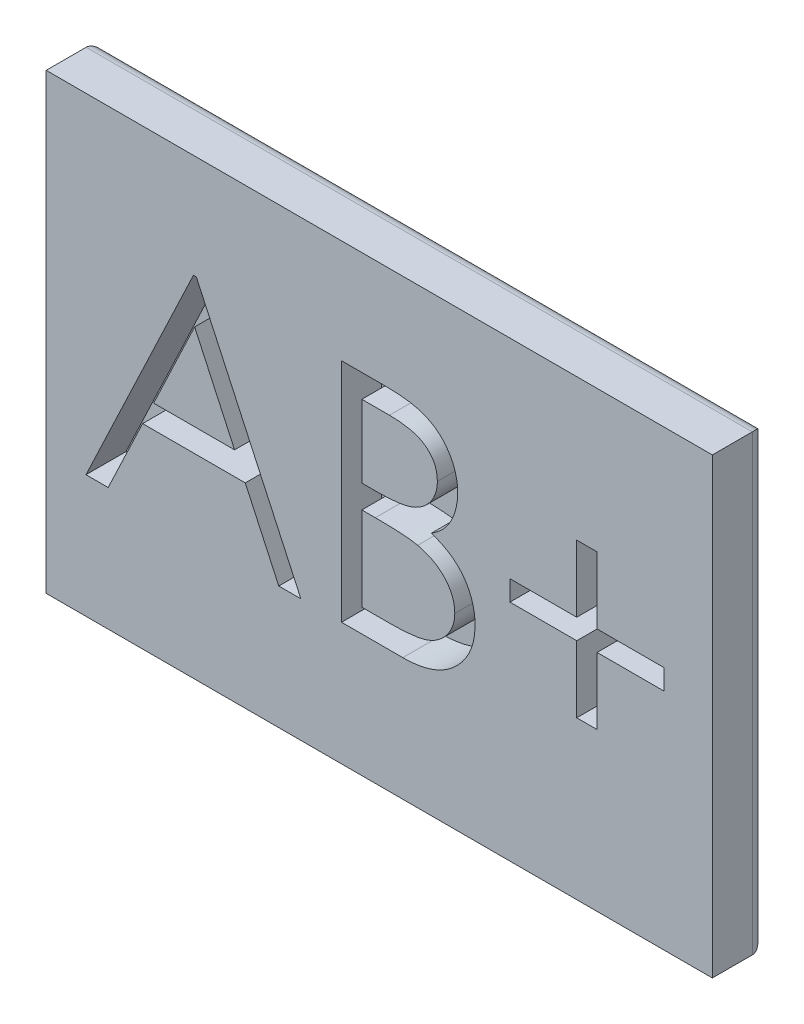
SolidWorks part; units mm, degrees
ref_plane "Front Plane" through (0, 0, 0) normal (0, 0, 1) x (1, 0, 0)
ref_plane "Top Plane" through (0, 0, 0) normal (0, 1, 0) x (1, 0, 0)
ref_plane "Right Plane" through (0, 0, 0) normal (1, 0, 0) x (0, 0, -1)
sketch "Sketch1" plane through (0, 0, 0) normal (0, 0, 1) x (1, 0, 0)
  line L1 (-15.875, -10.795) -> (15.875, -10.795)
  line L2 (-15.875, -10.795) -> (-15.875, 10.795)
  line L3 (-15.875, 10.795) -> (15.875, 10.795)
  line L4 (15.875, -10.795) -> (15.875, 10.795)
  line L5 (-15.875, -10.795) -> (15.875, 10.795) construction
  line L6 (-15.875, 10.795) -> (15.875, -10.795) construction
  point P0 (0, 0)
  dimension "D1" = 31.75
  dimension "D2" = 21.59
extrude "Boss-Extrude1" add sketch "Sketch1" along normal blind 2.54
fillet "Fillet1" radius 0.635 4 edges at (-15.875, 0, 0) (0, -10.795, 0) (0, 10.795, 0) (15.875, 0, 0)
sketch "Sketch2" plane through (0, 0, 2.54) normal (0, 0, 1) x (1, 0, 0)
  line L0 (-15.875, 10.795) -> (-14.977, 9.897) construction
  line L2 (-14.977, 9.897) -> (-14.977, 4.9485) construction
  line L3 (-14.977, 4.9485) -> (-14.977, 0) construction
  line L4 (-14.977, 0) -> (-14.977, -4.9485) construction
  line L5 (-14.977, -4.9485) -> (-14.977, -9.897) construction
  line L6 (-14.977, -9.897) -> (-15.875, -10.795) construction
  line L7 (15.875, 10.795) -> (-15.875, 10.795) construction
  line L8 (-15.875, -10.795) -> (15.875, -10.795) construction
  line L9 (-14.977, 4.9485) -> (14.977, 4.9485) construction
  line L10 (14.977, 4.9485) -> (14.977, 0) construction
  line L11 (14.977, 0) -> (-14.977, 0) construction
  line L12 (14.977, 0) -> (14.977, -4.9485) construction
  line L13 (14.977, -4.9485) -> (-14.977, -4.9485) construction
  line L14 (-14.977, -9.897) -> (14.977, -9.897) construction
  line L15 (14.977, -9.897) -> (14.977, -4.9485) construction
  line L16 (-14.977, 9.897) -> (14.977, 9.897) construction
  line L17 (14.977, 9.897) -> (14.977, 4.9485) construction
  line L18 (14.977, 9.897) -> (15.875, 10.795) construction
  line L19 (14.977, -9.897) -> (15.875, -10.795) construction
  text T0 "AB+" font "Century Gothic" height 10.795
  dimension "D1" = 45
  dimension "D2" = 45
  dimension "D3" = 1.27
extrude "Cut-Extrude1" cut sketch "Sketch2" against normal blind 1.905
